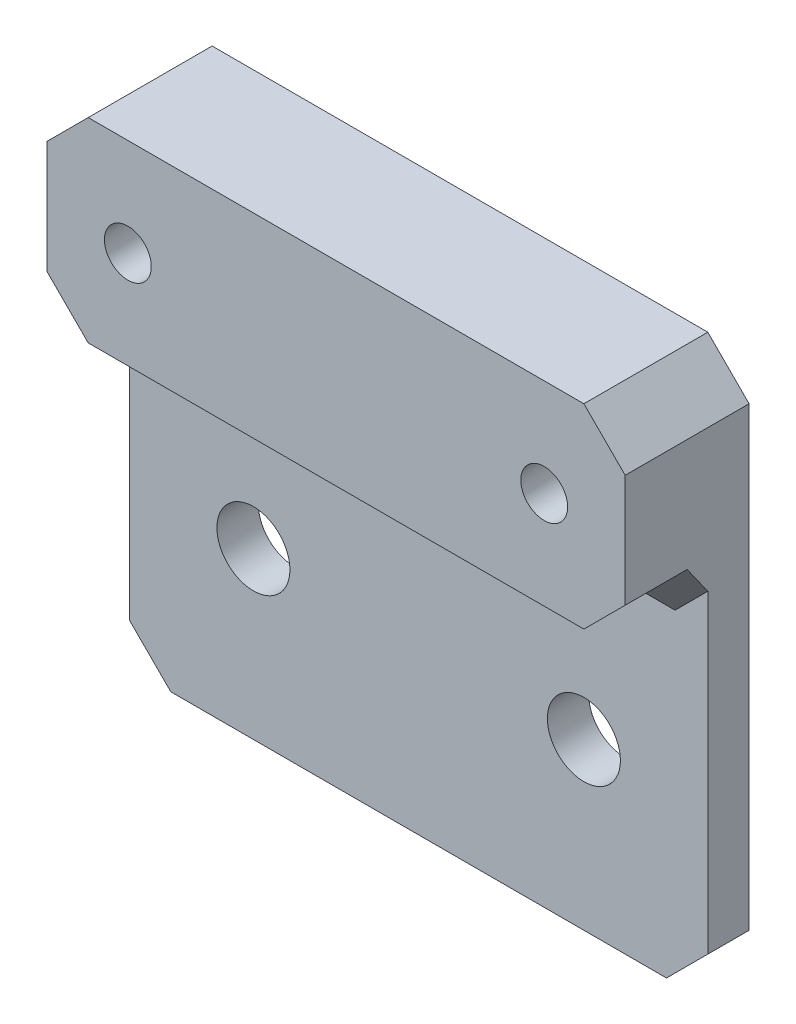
SolidWorks part; units mm, degrees
ref_plane "Front" through (0, 0, 0) normal (0, 0, 1) x (1, 0, 0)
ref_plane "Top" through (0, 0, 0) normal (0, 1, 0) x (1, 0, 0)
ref_plane "Right" through (0, 0, 0) normal (1, 0, 0) x (0, 0, -1)
sketch "Sketch1" plane through (0, 0, 0) normal (0, 0, 1) x (1, 0, 0)
  line L0 (-22.225, 0) -> (-12.7, 0) construction
  line L1 (-22.225, 12.7) -> (22.225, 12.7) construction
  line L2 (-22.225, 12.7) -> (-22.225, -12.7)
  line L3 (-22.225, -12.7) -> (22.225, -12.7)
  line L4 (22.225, 12.7) -> (22.225, -12.7)
  line L5 (-22.225, 12.7) -> (22.225, -12.7) construction
  line L6 (-22.225, -12.7) -> (22.225, 12.7) construction
  line L7 (-12.7, 0) -> (12.7, 0) construction
  line L8 (12.7, 0) -> (22.225, 0) construction
  line L9 (-22.225, 13.7) -> (-22.225, 28.7)
  line L10 (-22.225, 28.7) -> (22.225, 28.7)
  line L11 (22.225, 28.7) -> (22.225, 13.7)
  line L12 (-22.225, 13.7) -> (22.225, 13.7) construction
  line L13 (22.225, 13.7) -> (22.225, 12.7)
  line L14 (-22.225, 13.7) -> (-22.225, 12.7)
  point P0 (0, 0)
  dimension "D1" = 25.4
  dimension "D2" = 44.45
  dimension "D3" = 25.4
  dimension "D4" = 15
  dimension "D5" = 1
extrude "Boss-Extrude1" add sketch "Sketch1" along normal blind 3.175
sketch "Sketch2" plane through (0, 0, 3.175) normal (0, 0, 1) x (1, 0, 0)
  line L1 (-22.225, 28.7) -> (22.225, 28.7)
  line L2 (-22.225, 28.7) -> (-22.225, 13.7)
  line L3 (-22.225, 13.7) -> (22.225, 13.7)
  line L4 (22.225, 28.7) -> (22.225, 13.7)
  point P5 (0, 0)
  point P7 (0, 0)
  point P8 (20.5488, 16.1821)
extrude "Boss-Extrude2" add sketch "Sketch2" along normal blind 6.35
sketch "Sketch3" plane through (0, 0, 9.525) normal (0, 0, 1) x (1, 0, 0)
  line L0 (-22.225, 21.2) -> (-16, 21.2) construction
  line L1 (-22.225, 28.7) -> (-22.225, 13.7) construction
  line L2 (-16, 21.2) -> (16, 21.2) construction
  line L3 (16, 21.2) -> (22.225, 21.2) construction
  line L4 (22.225, 13.7) -> (22.225, 28.7) construction
  dimension "D1" = 32
hole_wizard "CBORE for M3 Hex Head Machine Screw1" positions "Sketch5" profile "Sketch6" counterbore size "M3" standard "ANSI Metric"
sketch "Sketch5" plane through (0, 0, 0) normal (0, 0, -1) x (-1, 0, 0)
  point P0 (-16, 21.2)
  point P2 (16, 21.2)
  point P6 (0, 0)
sketch "Sketch6" plane through (16, 21.2, 0) normal (1, 0, 0) x (0, 1, 0)
  line L0 (0, 0) -> (0, 9.525)
  line L1 (0, 9.525) -> (1.8, 9.525)
  line L3 (1.8, 9.525) -> (1.8, 2.3)
  line L4 (1.8, 2.3) -> (4.2, 2.3)
  line L5 (4.2, 2.3) -> (4.2, 0)
  line L7 (4.2, 0) -> (0, 0)
  line L11 (0, -6.35) -> (0, 107.95) construction
  dimension "Thru Hole Dia." = 3.6
  dimension "Thru Hole Depth" = 9.525
  dimension "C'Bore Dia." = 8.4
  dimension "C'Bore Depth" = 2.3
chamfer "Chamfer2" distance 3.175 angle 45 6 edges at (22.225, 13.7, 6.35) (-22.225, 13.7, 6.35) (-22.225, 28.7, 4.7625) (22.225, 28.7, 4.7625) (22.225, -12.7, 1.5875) (-22.225, -12.7, 1.5875)
chamfer "Chamfer1" distance 1.5875 angle 45 3 edges at (0, 13.7, 3.175) (20.6375, 15.2875, 3.175) (-20.6375, 15.2875, 3.175)
hole_wizard "#10 Clearance Hole1" positions "Sketch7" profile "Sketch8" hole size "#10" standard "ANSI Inch"
sketch "Sketch7" plane through (0, 0, 3.175) normal (0, 0, 1) x (1, 0, 0)
  point P0 (-12.7, 0)
  point P2 (12.7, 0)
sketch "Sketch8" plane through (-12.7, 0, 3.175) normal (1, 0, 0) x (0, -1, 0)
  line L0 (0, 0) -> (0, 3.175)
  line L1 (0, 3.175) -> (2.8067, 3.175)
  line L2 (2.8067, 3.175) -> (2.8067, 0)
  line L5 (2.8067, 0) -> (0, 0)
  line L11 (0, -6.35) -> (0, 107.95) construction
  dimension "Thru Hole Dia." = 5.6134
  dimension "Thru Hole Depth" = 3.175
